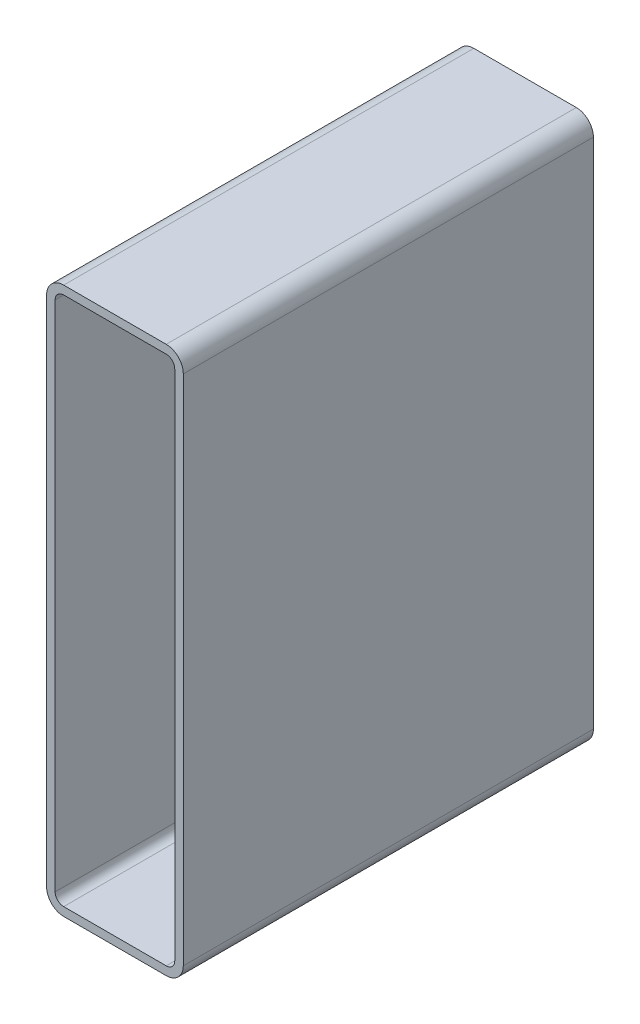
SolidWorks part; units mm, degrees
ref_plane "Front Plane" through (0, 0, 0) normal (0, 0, 1) x (1, 0, 0)
ref_plane "Top Plane" through (0, 0, 0) normal (0, 1, 0) x (1, 0, 0)
ref_plane "Right Plane" through (0, 0, 0) normal (1, 0, 0) x (0, 0, -1)
sketch "Sketch1" plane through (0, 0, 0) normal (0, 0, 1) x (1, 0, 0)
sketch_block_instance "HSS16x4x0.250-1"
sketch_block "HSS16x4x0.250"
extrude "Boss-Extrude1" add sketch "Sketch1" along normal blind 304.8
